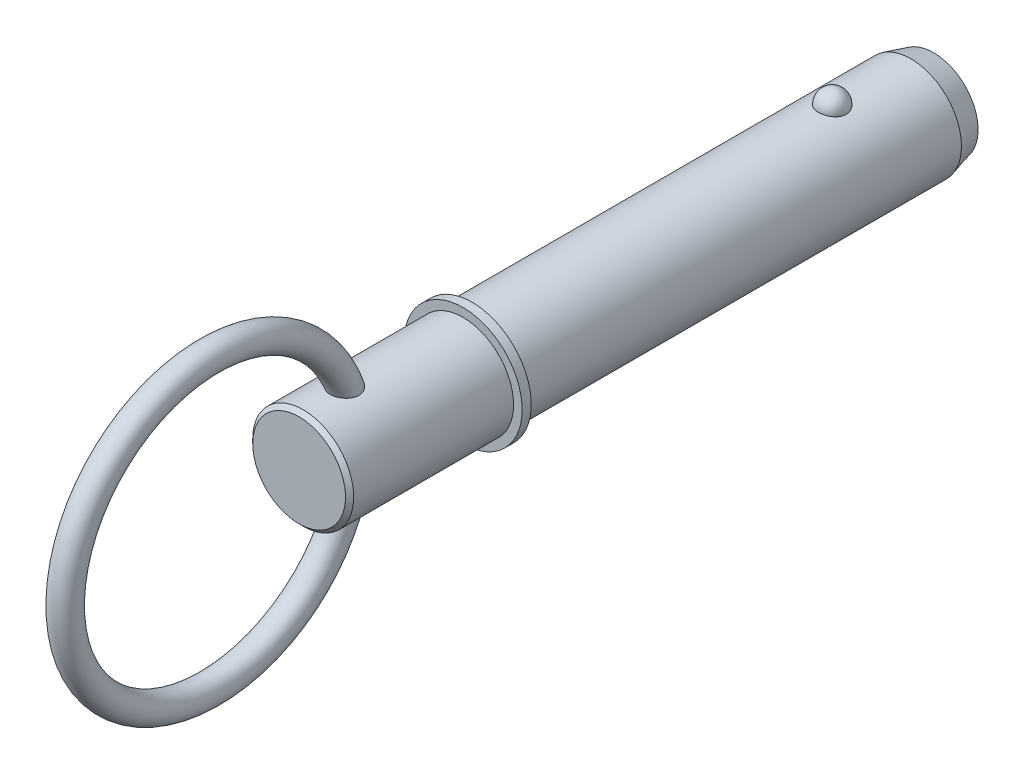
SolidWorks part; units mm, degrees
ref_plane "Front Plane" through (0, 0, 0) normal (0, 0, 1) x (1, 0, 0)
ref_plane "Top Plane" through (0, 0, 0) normal (0, 1, 0) x (1, 0, 0)
ref_plane "Right Plane" through (0, 0, 0) normal (1, 0, 0) x (0, 0, -1)
sketch "Sketch2" plane through (0, 0, 0) normal (0, 0, 1) x (1, 0, 0)
  circle A0 centre (0, 0) radius 11.115
  point P3 (0, 11.115)
  dimension "D1" = 22.23
extrude "Boss-Extrude1" add sketch "Sketch2" along normal blind 76.2
sketch "Sketch3" plane through (0, 0, 0) normal (0, 0, -1) x (-1, 0, 0)
  circle A0 centre (0, 0) radius 11.115
  dimension "D1" = 22.23
extrude "Boss-Extrude2" add sketch "Sketch3" along normal blind 25.4
chamfer "Chamfer1" distance 5 angle 15 1 edges at (-11.115, 0, -25.4)
sketch "Sketch18" plane through (0, 0, 0) normal (1, 0, 0) x (0, 0, -1)
  line L0 (20.4, 11.115) -> (-76.2, 11.115) construction
  line L1 (3.07, 14.185) -> (3.07, 8.045)
  line L2 (-76.2, -11.115) -> (20.4, -11.115) construction
  arc A0 (3.07, 14.185) -> (3.07, 8.045) centre (3.07, 11.115) ccw
  point P4 (0, 11.115)
  dimension "D1" = 25.3
revolve "Revolve1" add sketch "Sketch18" angle 360 about L1
sketch "Sketch19" plane through (0, 0, 0) normal (1, 0, 0) x (0, 0, -1)
  line L0 (-33.7288, 0) -> (-46.4542, 0) construction
sketch "Sketch20" plane through (0, 0, 0) normal (1, 0, 0) x (0, 0, -1)
  line L0 (-76.2, 0) -> (-76.2, 13)
  line L1 (-76.2, 11.115) -> (-76.2, -11.115) construction
  line L2 (-76.2, 13) -> (-78.2, 13)
  line L3 (-78.2, 13) -> (-78.2, 0)
  line L4 (-33.7288, 0) -> (-46.4542, 0) construction
  line L5 (-78.2, 0) -> (-76.2, 0)
  dimension "D1" = 13
  dimension "D2" = 2
revolve "Revolve2" add sketch "Sketch20" angle 360 about L0
sketch "Sketch21" plane through (0, 0, 76.2) normal (0, 0, -1) x (-1, 0, 0)
  circle A0 centre (0, 0) radius 11.115
  dimension "D1" = 22.23
extrude "Boss-Extrude3" add sketch "Sketch21" against normal blind 38.1
chamfer "Chamfer2" distance 0.9 angle 45 1 edges at (-11.115, 0, 114.3)
sketch "Sketch23" plane through (0, 0, 0) normal (1, 0, 0) x (0, 0, -1)
  line L0 (-114.3, 10.215) -> (-114.3, -10.215) construction
  circle A0 centre (-134.05, 0) radius 31.75
  point P2 (-102.3, 0)
  dimension "D1" = 63.5
  dimension "D2" = 12
sketch "Sketch24" plane through (0, 0, 0) normal (0, 1, 0) x (1, 0, 0)
  circle A0 centre (0, -102.3) radius 3
  dimension "D1" = 6
sweep "Sweep1" add profiles "Sketch24" path "Sketch23"
